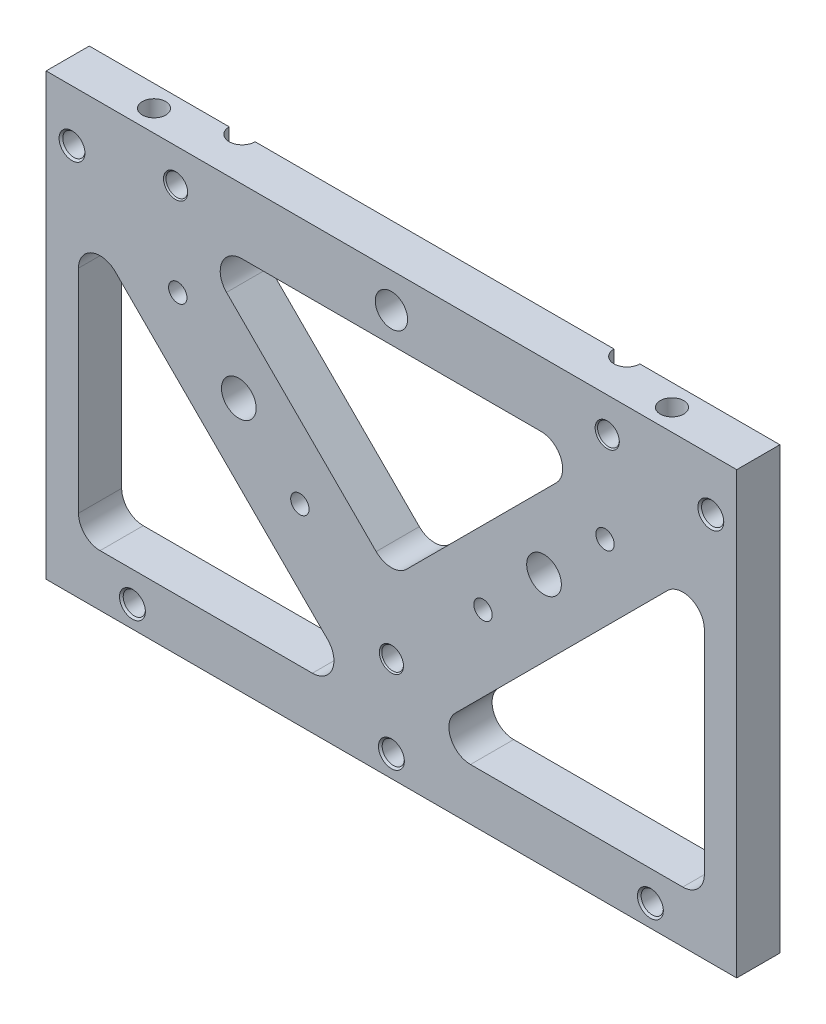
SolidWorks part; units mm, degrees
ref_plane "Front Plane" through (0, 0, 0) normal (0, 0, 1) x (1, 0, 0)
ref_plane "Top Plane" through (0, 0, 0) normal (0, 1, 0) x (1, 0, 0)
ref_plane "Right Plane" through (0, 0, 0) normal (1, 0, 0) x (0, 0, -1)
sketch "ReferenceGeometry" plane through (0, 0, 0) normal (0, 0, 1) x (1, 0, 0)
  line L5 (0, 60.8584) -> (0, -69.85) construction
  line L6 (0, -35.921) -> (-8.9803, -44.9013) construction
  line L7 (0, -35.921) -> (-35.921, 0) construction
  line L8 (-8.9803, -44.9013) -> (-44.9013, -8.9803) construction
  line L9 (-35.921, 0) -> (-44.9013, -8.9803) construction
  line L12 (0, 0) -> (-43.7675, -43.7675) construction
  circle A0 centre (0, 31.75) radius 25.4 construction
  point P19 (-17.9605, -17.9605)
  dimension "D1" = 50.8
  dimension "D2" = 35.921
  dimension "D4" = 31.75
  dimension "D6" = 50.8
  dimension "D7" = 12.7
  dimension "D8" = 45
  dimension "D9" = 101.6
sketch "Sketch2" plane through (0, 0, 0) normal (0, 0, 1) x (1, 0, 0)
  line L0 (0, 60.8584) -> (0, -69.85) construction
  line L1 (-50.8, -59.69) -> (50.8, -59.69)
  line L2 (-50.8, -59.69) -> (-50.8, 5.08)
  line L3 (-50.8, 5.08) -> (50.8, 5.08)
  line L4 (50.8, -59.69) -> (50.8, 5.08)
  line L5 (-50.8, -59.69) -> (50.8, 5.08) construction
  line L6 (-50.8, 5.08) -> (50.8, -59.69) construction
  point P0 (0, -27.305)
  dimension "D1" = 5.08
  dimension "D2" = 101.6
  dimension "D3" = 64.77
extrude "Boss-Extrude1" add sketch "Sketch2" along normal blind 6.35
hole_wizard "3/16 (0.1875) Diameter Hole1" positions "Sketch5" profile "Sketch4" hole size "3/16" standard "Ansi Inch"
sketch "Sketch5" plane through (0, 0, 6.35) normal (0, 0, 1) x (1, 0, 0)
  point P0 (0, 0)
sketch "Sketch4" plane through (0, 0, 6.35) normal (1, 0, 0) x (0, -1, 0)
  line L0 (0, 0) -> (0, 6.35)
  line L1 (0, 6.35) -> (2.3812, 6.35)
  line L2 (2.3812, 6.35) -> (2.3812, 0)
  line L5 (2.3812, 0) -> (0, 0)
  line L11 (0, -6.35) -> (0, 107.95) construction
  dimension "Thru Hole Dia." = 4.7625
  dimension "Thru Hole Depth" = 6.35
hole_wizard "#6-32 Tapped Hole1" positions "Sketch17" profile "Sketch16" tap size "#6-32" standard "Ansi Inch"
sketch "Sketch17" plane through (0, 0, 6.35) normal (0, 0, 1) x (1, 0, 0)
  line L0 (-31.4309, -13.4704) -> (-13.4704, -31.4309) construction
  line L3 (0, -35.921) -> (-35.921, 0) construction
  line L4 (0, 0) -> (-43.7675, -43.7675) construction
  line L5 (-35.921, 0) -> (-44.9013, -8.9803) construction
  point P0 (-31.4309, -13.4704)
  point P1 (-13.4704, -31.4309)
  point P12 (-22.4506, -22.4506)
  point P17 (-40.4112, -4.4901)
  dimension "D1" = 25.4
sketch "Sketch16" plane through (-31.4309, -13.4704, 6.35) normal (1, 0, 0) x (0, -1, 0)
  line L0 (0, 0) -> (0, 6.35)
  line L1 (0, 6.35) -> (1.3525, 6.35)
  line L2 (1.3525, 6.35) -> (1.3525, 0)
  line L5 (1.3525, 0) -> (0, 0)
  line L11 (0, -6.35) -> (0, 107.95) construction
  dimension "Thread Major Dia." = 2.7051
  dimension "Thru Tap Drill Depth" = 6.35
sketch "Sketch6" plane through (0, 0, 0) normal (0, 0, -1) x (-1, 0, 0)
  circle A0 centre (0, 0) radius 3.1877
  dimension "D1" = 6.3754
extrude "Cut-Extrude2" cut sketch "Sketch6" against normal blind 0.762
hole_wizard "#4 Clearance Hole2" positions "Sketch8" profile "Sketch7" hole size "#4" standard "Ansi Inch"
sketch "Sketch8" plane through (0, 0, 0) normal (0, 0, -1) x (-1, 0, 0)
  line L0 (-38.1, -56.515) -> (38.1, -56.515) construction
  line L3 (0, 60.8584) -> (0, -69.85) construction
  line L4 (50.8, -59.69) -> (-50.8, -59.69) construction
  point P0 (-38.1, -56.515)
  point P7 (0, -56.515)
  point P13 (0, -56.515)
  point P15 (38.1, -56.515)
  dimension "D1" = 3.175
  dimension "D2" = 76.2
sketch "Sketch7" plane through (38.1, -56.515, 0) normal (1, 0, 0) x (0, 1, 0)
  line L0 (0, 0) -> (0, 6.35)
  line L1 (0, 6.35) -> (1.905, 6.35)
  line L2 (1.6319, 6.0769) -> (1.6319, 0.273)
  line L3 (1.6319, 0.273) -> (1.905, 0)
  line L5 (1.905, 0) -> (0, 0)
  line L6 (-1.6319, 0.273) -> (-1.905, 0) construction
  line L7 (1.905, 6.35) -> (1.6319, 6.0769)
  line L8 (-1.905, 6.35) -> (-1.632, 6.0769) construction
  line L11 (0, -6.35) -> (0, 107.95) construction
  dimension "Thru Hole Dia." = 3.2639
  dimension "Thru Hole Depth" = 6.35
  dimension "Near C'Sink Dia." = 3.81
  dimension "Near C'Sink Angle" = 90
  dimension "Far C'Sink Dia." = 3.81
  dimension "Far C'Sink Angle" = 90
hole_wizard "#4 Clearance Hole3" positions "Sketch13" profile "Sketch14" hole size "#4" standard "Ansi Inch"
sketch "Sketch13" plane through (0, 0, 6.35) normal (0, 0, 1) x (1, 0, 0)
  line L0 (-50.8, 5.08) -> (-50.8, -59.69) construction
  line L3 (50.8, -59.69) -> (50.8, 5.08) construction
  line L4 (50.8, 5.08) -> (-50.8, 5.08) construction
  point P0 (-46.99, -2.54)
  point P1 (46.99, -2.54)
  dimension "D1" = 3.81
  dimension "D2" = 7.62
  dimension "D4" = 3.81
sketch "Sketch14" plane through (-46.99, -2.54, 6.35) normal (1, 0, 0) x (0, -1, 0)
  line L0 (0, 0) -> (0, 6.35)
  line L1 (0, 6.35) -> (1.905, 6.35)
  line L2 (1.6319, 6.0769) -> (1.632, 0.273)
  line L3 (1.632, 0.273) -> (1.905, 0)
  line L5 (1.905, 0) -> (0, 0)
  line L6 (-1.632, 0.273) -> (-1.905, 0) construction
  line L7 (1.905, 6.35) -> (1.6319, 6.0769)
  line L8 (-1.905, 6.35) -> (-1.632, 6.0769) construction
  line L11 (0, -6.35) -> (0, 107.95) construction
  dimension "Thru Hole Dia." = 3.2639
  dimension "Thru Hole Depth" = 6.35
  dimension "Near C'Sink Dia." = 3.81
  dimension "Near C'Sink Angle" = 90
  dimension "Far C'Sink Dia." = 3.81
  dimension "Far C'Sink Angle" = 90
sketch "Sketch15" plane through (0, 0, 6.35) normal (0, 0, 1) x (1, 0, 0)
  line L0 (-46.0375, -9.9993) -> (-3.9668, -52.07)
  line L1 (-3.9668, -52.07) -> (-46.0375, -52.07)
  line L2 (-46.0375, -52.07) -> (-46.0375, -9.9993)
  line L3 (-29.68, -4.445) -> (0, -34.125)
  line L4 (0, -34.125) -> (29.68, -4.445)
  line L5 (29.68, -4.445) -> (-29.68, -4.445)
  line L6 (46.0375, -9.9993) -> (46.0375, -52.07)
  line L7 (46.0375, -52.07) -> (3.9668, -52.07)
  line L8 (3.9668, -52.07) -> (46.0375, -9.9993)
  line L9 (-50.8, 5.08) -> (-50.8, -59.69) construction
  line L10 (50.8, -59.69) -> (50.8, 5.08) construction
  line L11 (-50.8, -59.69) -> (50.8, -59.69) construction
  line L13 (-8.9803, -44.9013) -> (-44.9013, -8.9803) construction
  line L14 (50.8, 5.08) -> (-50.8, 5.08) construction
  line L16 (0, -35.921) -> (-35.921, 0) construction
  dimension "D1" = 4.7625
  dimension "D2" = 4.7625
  dimension "D3" = 7.62
  dimension "D4" = 1.524
  dimension "D5" = 1.27
  dimension "D6" = 9.525
extrude "Cut-Extrude4" cut sketch "Sketch15" against normal through all
fillet "Fillet15" radius 3.175 2 edges at (29.68, -4.445, 3.175) (-29.68, -4.445, 3.175)
fillet "Fillet23" radius 3.175 1 edges at (46.0375, -9.9993, 3.175)
fillet "Fillet24" radius 3.175 2 edges at (3.9668, -52.07, 3.175) (46.0375, -52.07, 3.175)
fillet "Fillet25" radius 3.175 1 edges at (0, -34.125, 3.175)
fillet "Fillet26" radius 3.175 3 edges at (-46.0375, -52.07, 3.175) (-46.0375, -9.9993, 3.175) (-3.9668, -52.07, 3.175)
mirror "Mirror1" about plane through (0, 0, 0) normal (1, 0, 0) of "#6-32 Tapped Hole1"
hole_wizard "1/8 (0.125) Diameter Hole1" positions "Sketch19" profile "Sketch18" hole size "1/8" standard "Ansi Inch"
sketch "Sketch19" plane through (0, 0, 6.35) normal (0, 0, 1) x (1, 0, 0)
  line L0 (-31.75, 0) -> (31.75, 0) construction
  line L3 (0, 0) -> (0, -44.45) construction
  point P0 (-31.75, 0)
  point P1 (31.75, 0)
  point P3 (0, -44.45)
  dimension "D1" = 44.45
  dimension "D2" = 63.5
sketch "Sketch18" plane through (-31.75, 0, 6.35) normal (1, 0, 0) x (0, -1, 0)
  line L0 (0, 0) -> (0, 6.35)
  line L1 (0, 6.35) -> (1.778, 6.35)
  line L2 (1.6002, 6.1722) -> (1.6002, 0.1778)
  line L3 (1.6002, 0.1778) -> (1.778, 0)
  line L5 (1.778, 0) -> (0, 0)
  line L6 (-1.6002, 0.1778) -> (-1.778, 0) construction
  line L7 (1.778, 6.35) -> (1.6002, 6.1722)
  line L8 (-1.778, 6.35) -> (-1.6002, 6.1722) construction
  line L11 (0, -6.35) -> (0, 107.95) construction
  dimension "Thru Hole Dia." = 3.2004
  dimension "Thru Hole Depth" = 6.35
  dimension "Near C'Sink Dia." = 3.556
  dimension "Near C'Sink Angle" = 90
  dimension "Far C'Sink Dia." = 3.556
  dimension "Far C'Sink Angle" = 90
hole_wizard "#8-32 Tapped Hole1" positions "Sketch21" profile "Sketch20" tap size "#8-32" standard "Ansi Inch"
sketch "Sketch21" plane through (0, 5.08, 0) normal (0, 1, 0) x (-1, 0, 0)
  line L0 (-50.8, 3.175) -> (50.8, 3.175) construction
  line L1 (-50.8, 6.35) -> (-50.8, 0) construction
  line L2 (50.8, 6.35) -> (50.8, 0) construction
  point P3 (-38.1, 3.175)
  point P5 (38.1, 3.175)
  dimension "D1" = 38.1
  dimension "D2" = 38.1
sketch "Sketch20" plane through (38.1, 5.08, 3.175) normal (1, 0, 0) x (0, 0, 1)
  line L0 (0, 0) -> (0, 27.9618)
  line L1 (0, 27.9618) -> (1.7272, 26.924)
  line L2 (1.7272, 26.924) -> (1.7272, 0)
  line L5 (1.7272, 0) -> (0, 0)
  line L10 (0, 27.9618) -> (-1.7272, 26.924) construction
  line L11 (0, -6.35) -> (0, 107.95) construction
  dimension "Tap Drill Dia." = 3.4544
  dimension "Tap Drill Depth" = 26.924
  dimension "Drill Angle" = 118
hole_wizard "1/4-20 Tapped Hole1" positions "Sketch23" profile "Sketch22" tap size "1/4-20" standard "Ansi Inch"
sketch "Sketch23" plane through (0, 0, 0) normal (0, 0, -1) x (-1, 0, 0)
  line L0 (-31.4309, -13.4704) -> (-13.4704, -31.4309) construction
  line L3 (13.4704, -31.4309) -> (31.4309, -13.4704) construction
  point P0 (-22.4506, -22.4506)
  point P16 (22.4506, -22.4506)
sketch "Sketch22" plane through (22.4506, -22.4506, 0) normal (1, 0, 0) x (0, 1, 0)
  line L0 (0, 0) -> (0, 6.35)
  line L1 (0, 6.35) -> (2.5527, 6.35)
  line L2 (2.5527, 6.35) -> (2.5527, 0)
  line L5 (2.5527, 0) -> (0, 0)
  line L11 (0, -6.35) -> (0, 107.95) construction
  dimension "Thru Tap Drill Dia." = 5.1054
  dimension "Thru Tap Drill Depth" = 6.35
sketch "Sketch24" plane through (0, 5.08, 0) normal (0, 1, 0) x (1, 0, 0)
  line L0 (-50.8, -6.35) -> (-50.8, 0) construction
  line L1 (50.8, 0) -> (-50.8, 0) construction
  line L2 (-26.3982, 0) -> (-30.2082, 0)
  line L6 (26.3982, 0) -> (30.2082, 0)
  line L7 (50.8, -6.35) -> (50.8, 0) construction
  arc A0 (26.3982, 0) -> (30.2082, 0) centre (28.3032, 0) ccw
  arc A1 (-26.3982, 0) -> (-30.2082, 0) centre (-28.3032, 0) cw
  dimension "D2" = 22.4968
  dimension "D1" = 22.4968
  dimension "D3" = 3.81
  dimension "D4" = 3.81
extrude "Cut-Extrude5" cut sketch "Sketch24" against normal blind 2.54
